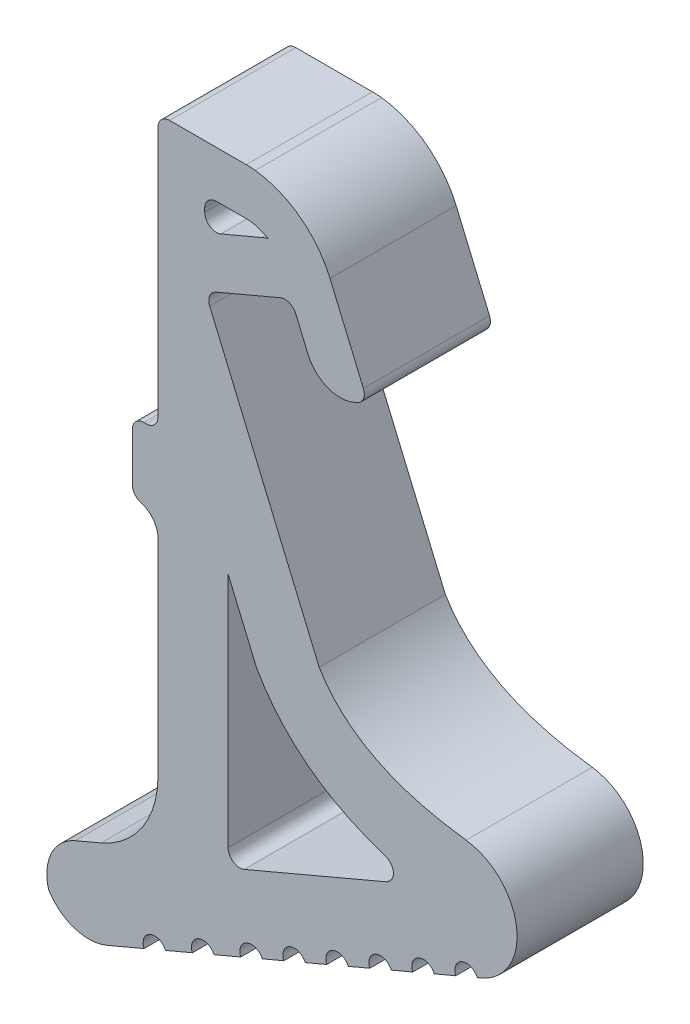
SolidWorks part; units mm, degrees
ref_plane "前视基准面" through (0, 0, 0) normal (0, 0, 1) x (1, 0, 0)
ref_plane "上视基准面" through (0, 0, 0) normal (0, 1, 0) x (1, 0, 0)
ref_plane "右视基准面" through (0, 0, 0) normal (1, 0, 0) x (0, 0, -1)
sketch "草图1" plane through (0, 0, 0) normal (0, 0, 1) x (1, 0, 0)
  line L0 (0, 31) -> (0, -31)
  line L1 (0, -31) -> (29.0782, -18.6571)
  line L2 (29.0782, -18.6571) -> (8, 31)
  line L3 (0, 31) -> (8, 31)
  dimension "D1" = 67
  dimension "D2" = 8
  dimension "D3" = 62
extrude "凸台-拉伸1" add sketch "草图1" along normal mid plane 10.8
sketch "草图2" plane through (0, 0, 0) normal (-1, 0, 0) x (0, 0, 1)
  line L0 (5.4, 31) -> (-5.4, 31) construction
  circle A0 centre (0, 26) radius 1.65
  circle A1 centre (0, 13) radius 1.65
  point P4 (0, 31)
  dimension "D3" = 3.3
  dimension "D4" = 3.3
  dimension "D1" = 5
  dimension "D2" = 13
extrude "切除-拉伸1" cut sketch "草图2" against normal blind 5 draft 5
fillet "圆角1" radius 0.6 2 edges at (0, 13, 1.65) (0, 26, 1.65)
sketch "草图3" plane through (0, 0, 0) normal (-1, 0, 0) x (0, 0, 1)
  line L0 (-5.4, 31) -> (-5.4, -31) construction
  line L1 (-5.4, 7.5) -> (5.4, 7.5)
  line L2 (-5.4, 7.5) -> (-5.4, 1.5)
  line L3 (-5.4, 1.5) -> (5.4, 1.5)
  line L4 (5.4, 7.5) -> (5.4, 1.5)
  line L5 (5.4, 31) -> (5.4, -31) construction
  line L6 (5.4, 31) -> (-5.4, 31) construction
  dimension "D1" = 23.5
  dimension "D2" = 6
extrude "凸台-拉伸2" add sketch "草图3" along normal blind 2.2
fillet "圆角2" radius 2 1 edges at (0, 1.5, 0)
fillet "圆角3" radius 1 4 edges at (-2.2, 1.5, 0) (-2.2, 7.5, 0) (0, 7.5, 0) (0, 31, 0)
sketch "草图4" plane through (0, 0, 5.4) normal (0, 0, 1) x (1, 0, 0)
  line L0 (14.0211, 16.8152) -> (8, 31)
  line L1 (29.0782, -18.6571) -> (8, 31) construction
  line L2 (14.0211, 16.8152) -> (17.9793, 18.4953)
  line L3 (17.9793, 18.4953) -> (12.8998, 30.4619)
  line L4 (8, 31) -> (12.8998, 30.4619)
  line L5 (0, -31) -> (29.0782, -18.6571) construction
  dimension "D2" = 4.3
  dimension "D3" = 10
  dimension "D4" = 13
extrude "凸台-拉伸3" add sketch "草图4" against normal up to surface (10.8 mm away)
fillet "圆角4" radius 8 2 edges at (12.8998, 30.4619, 0) (8, 31, 0)
sketch "草图5" plane through (0, 0, 5.4) normal (0, 0, 1) x (1, 0, 0)
  line L0 (14.0211, 16.8152) -> (11.4032, 22.9826)
  line L1 (11.4032, 22.9826) -> (4.0392, 19.8567)
  line L2 (4.0392, 19.8567) -> (27.483, -35.3736)
  line L3 (27.483, -35.3736) -> (34.8471, -32.2477)
  line L4 (29.0782, -18.6571) -> (14.0211, 16.8152) construction
  line L5 (34.8471, -32.2477) -> (14.0211, 16.8152)
  dimension "D1" = 8
  dimension "D2" = 60
  dimension "D3" = 6.7
extrude "切除-拉伸2" cut sketch "草图5" against normal through all
fillet "圆角5" radius 1 3 edges at (17.9793, 18.4953, 0) (4.0392, 19.8567, 0) (11.4032, 22.9826, 0)
sketch "草图7" plane through (0, 0, 5.4) normal (0, 0, 1) x (1, 0, 0)
  line L0 (4.4299, 18.9362) -> (21.7141, -21.7829) construction
  line L1 (45.6655, -11.6162) -> (21.7141, -21.7829)
  line L2 (21.7141, -21.7829) -> (13.8074, -3.1559)
  line L3 (10.4827, 22.5919) -> (4.9597, 20.2475) construction
  spline S0 degree 3 poles (13.8074, -3.1559) (16.8964, -8.2996) (24.5273, -9.6655) (31.4528, -10.097) (37.8839, -15.122) (43.0045, -10.4837) (45.6655, -11.6162) knots 0 0 0 0 0.425361 0.489671 0.626053 1 1 1 1
  dimension "D1" = 20
  dimension "D3" = 21.846
  dimension "D4" = 17.6685
  dimension "D6" = 34.7414
  dimension "D7" = 30.0901
  dimension "D2" = 25
  dimension "D5" = 45.6655
  dimension "D8" = 35.7375
  dimension "D9" = 10.0776
extrude "凸台-拉伸4" add sketch "草图7" against normal up to surface (10.8 mm away)
fillet "圆角6" radius 5 2 edges at (45.6655, -11.6162, 0) (0, -31, 0)
sketch "草图8" plane through (0, 0, 5.4) normal (0, 0, 1) x (1, 0, 0)
  line L0 (6, 0) -> (10.0908, 0)
  line L1 (8.7863, -15.4458) -> (13.0999, -4.6366)
  line L2 (10.755, -23.7546) -> (18.0211, -12.02)
  line L14 (7.562, 28) -> (3, 28)
  line L15 (7.562, 28) -> (3, 28)
  line L16 (7.562, 27) -> (4, 27)
  line L17 (7.562, 27) -> (4, 27)
  line L24 (4, 24.1856) -> (8.9198, 26.2739)
  line L26 (4, 27) -> (4, 24.1856)
  line L27 (4, 24.1856) -> (8.9198, 26.2739)
  line L29 (4, 25.985) -> (4, 22.6279)
  line L44 (3.7875, 23.009) -> (9.3105, 25.3534)
  line L47 (3, 28) -> (3, 22.5636)
  arc A0 (8.5264, 26.0863) -> (8.7287, 27.7101) centre (8.057, 26.9693) ccw
  arc A1 (5.2536, 21.6606) -> (4, 22.6279) centre (5, 22.6279) cw
  arc A2 (5.0547, 26.9835) -> (4, 25.985) centre (5, 25.985) ccw
  arc A3 (10.0908, 0) -> (12.8523, -1.8278) centre (10.0908, -3) cw
  arc A4 (6, 0) -> (3, -3) centre (6, -3) ccw
  arc A5 (14.4779, -28.0954) -> (10.755, -23.7546) centre (13.3057, -25.3339) cw
  arc A6 (3, -14.3339) -> (8.7863, -15.4458) centre (6, -14.3339) ccw
  arc A7 (18.0211, -12.02) -> (21.7862, -10.8562) centre (20.5717, -13.5994) cw
  arc A8 (13.0999, -4.6366) -> (13.075, -2.3525) centre (10.3135, -3.5247) ccw
  arc A22 (9.4189, 26.4551) -> (7.9011, 26.9856) centre (7.3672, 23.0214) ccw
  arc A23 (9.4189, 26.4551) -> (7.9011, 26.9856) centre (7.3672, 23.0214) ccw
  arc A24 (7.9011, 26.9856) -> (7.562, 27) centre (7.562, 23) ccw
  arc A25 (7.9011, 26.9856) -> (7.562, 27) centre (7.562, 23) ccw
  arc A26 (11.6543, 25.5944) -> (8.0103, 27.9799) centre (7.3672, 23.0214) ccw
  arc A27 (9.4189, 26.4551) -> (8.9198, 26.2739) centre (10.8734, 21.6713) ccw
  arc A28 (8.0103, 27.9799) -> (7.562, 28) centre (7.562, 23) ccw
  arc A31 (8.5264, 26.0863) -> (8.9198, 26.2739) centre (10.8734, 21.6713) ccw
  arc A48 (3.7875, 23.009) -> (3, 22.5636) centre (5.3504, 19.327) ccw
  arc A49 (11.6543, 25.5944) -> (9.3105, 25.3534) centre (10.8734, 21.6713) ccw
  point P13 (12.0765, 0)
  point P16 (3, 0)
  dimension "D3" = 1
  dimension "D4" = 3
  dimension "D5" = 3
  dimension "D6" = 3
  dimension "D7" = 21.6496
  dimension "D1" = 4
  dimension "D2" = 3
extrude "切除-拉伸3" [suppressed] cut sketch "草图8" against normal through all
sketch "草图11" plane through (0, 0, 5.4) normal (0, 0, 1) x (1, 0, 0)
  line L22 (6, -21.935) -> (22.2227, -15.0489)
  line L23 (8.448, -5.8858) -> (5.9897, -0.0943)
  line L24 (6, -0.5) -> (6, -21.935)
  line L25 (7.3907, -21.3447) -> (19.551, -16.1829)
  line L26 (8.448, -5.8858) -> (5.9897, -0.0943)
  line L27 (6, -0.5) -> (6, -20.4242)
  line L39 (4, 24.1856) -> (8.9198, 26.2739)
  line L40 (7.562, 27) -> (4, 27)
  line L41 (4, 27) -> (4, 24.1856)
  line L42 (5.3907, 24.7759) -> (8.9198, 26.2739)
  line L43 (7.562, 27) -> (5, 27)
  line L44 (4, 26) -> (4, 25.6964)
  arc A26 (6, -0.5) -> (5.9897, -0.0943) centre (-2, -0.5) ccw
  arc A27 (6, -0.5) -> (5.9897, -0.0943) centre (-2, -0.5) ccw
  arc A28 (19.551, -16.1829) -> (19.4662, -14.3104) centre (19.1602, -15.2624) ccw
  arc A29 (7.3907, -21.3447) -> (6, -20.4242) centre (7, -20.4242) cw
  arc A30 (5.3907, 24.7759) -> (4, 25.6964) centre (5, 25.6964) cw
  arc A31 (5, 27) -> (4, 26) centre (5, 26) ccw
  arc A41 (9.4189, 26.4551) -> (8.9198, 26.2739) centre (10.8734, 21.6713) ccw
  arc A42 (9.4189, 26.4551) -> (7.9011, 26.9856) centre (7.3672, 23.0214) ccw
  arc A43 (7.9011, 26.9856) -> (7.562, 27) centre (7.562, 23) ccw
  arc A44 (9.4189, 26.4551) -> (8.9198, 26.2739) centre (10.8734, 21.6713) ccw
  arc A45 (9.4189, 26.4551) -> (7.9011, 26.9856) centre (7.3672, 23.0214) ccw
  arc A46 (7.9011, 26.9856) -> (7.562, 27) centre (7.562, 23) ccw
  spline S2 degree 3 poles (-523.6377, -1935.4123) (230.3795, 174.8284) (78.4666, -36.8926) (16.8315, -13.3447) (15.5565, -12.7295) (13.126, -11.2031) (12.0174, -10.3205) (10.5314, -8.7982) (10.0641, -8.2555) (9.4162, -7.395) (9.2099, -7.1017) (-0.8865, 8.2953) (21.6139, 45.1609) (-1680.4202, -1076.6214) knots -11.194398 -11.194398 -11.194398 -11.194398 0.25 0.25 0.5 0.5 0.75 0.75 0.875 0.875 0.9375 0.9375 4.08444 4.08444 4.08444 4.08444 only from (22.2227, -15.0489) to (8.448, -5.8858)
  spline S3 degree 3 poles (19.4662, -14.3104) (19.0227, -14.1678) (18.5835, -14.0141) (16.8315, -13.3447) (15.5565, -12.7295) (13.126, -11.2031) (12.0174, -10.3205) (10.5314, -8.7982) (10.0641, -8.2555) (9.4162, -7.395) (9.2099, -7.1017) (8.8167, -6.502) (8.6329, -6.1936) (8.448, -5.8858) knots 0.167576 0.167576 0.167576 0.167576 0.25 0.25 0.5 0.5 0.75 0.75 0.875 0.875 0.9375 0.9375 1 1 1 1
  dimension "D3" = 1
  dimension "D1" = 6
  dimension "D2" = 4
extrude "切除-拉伸6" cut sketch "草图11" against normal through all
sketch "草图12" plane through (0, 0, 5.4) normal (0, 0, 1) x (1, 0, 0)
  line L0 (6.9537, -28.0483) -> (27.7033, -19.2406) construction
  circle A0 centre (8.0099, -27.6) radius 1
  dimension "D2" = 2
  dimension "D1" = 27.6
extrude "切除-拉伸7" cut sketch "草图12" against normal through all
pattern_linear "阵列(线性)2" count 6 spacing 4 along (0.9205, 0.3907, 0) of "切除-拉伸7"
sketch "草图9" plane through (0, 0, 5.4) normal (0, 0, 1) x (1, 0, 0)
  line L23 (7.5548, -6.3408) -> (7, -5.0337)
  line L24 (7, -5.0337) -> (7, -19.5574)
  line L26 (7.5548, -6.3408) -> (7, -5.0337)
  line L27 (7, -5.0337) -> (7, -18.0466)
  arc A0 (16.8972, -16.2231) -> (16.8571, -14.4034) centre (16.4628, -15.3223) ccw
  arc A1 (8.3907, -18.9671) -> (7, -18.0466) centre (8, -18.0466) cw
  arc A21 (10.5063, -18.1254) -> (7, -19.5574) centre (11.6919, -26.0371) ccw
  arc A22 (10.5063, -18.1254) -> (7, -19.5574) centre (11.6919, -26.0371) ccw
  arc A23 (14.1884, -16.5625) -> (10.5063, -18.1254) centre (15.3739, -24.4742) ccw
  arc A24 (14.1884, -16.5625) -> (10.5063, -18.1254) centre (15.3739, -24.4742) ccw
  arc A25 (18.2494, -14.952) -> (14.1884, -16.5625) centre (19.056, -22.9112) ccw
  arc A26 (18.2494, -14.952) -> (14.1884, -16.5625) centre (19.056, -22.9112) ccw
  spline S2 degree 3 poles (-690.5665, -1880.7396) (275.8487, 204.7486) (74.8449, -45.6605) (14.5317, -13.2556) (14.0281, -12.9585) (13.0437, -12.3181) (12.5603, -11.9727) (11.1729, -10.88) (10.3306, -10.0779) (9.1942, -8.7616) (8.8366, -8.3039) (8.333, -7.5882) (8.1706, -7.3447) (-0.9842, 7.1527) (11.8898, 40.8929) (-1517.4111, -1299.6796) knots -14.28836 -14.28836 -14.28836 -14.28836 0.25 0.25 0.375 0.375 0.5 0.5 0.75 0.75 0.875 0.875 0.9375 0.9375 4.522796 4.522796 4.522796 4.522796 only from (18.2494, -14.952) to (7.5548, -6.3408)
  spline S3 degree 3 poles (16.8571, -14.4034) (16.2405, -14.1387) (15.6363, -13.8491) (14.5317, -13.2556) (14.0281, -12.9585) (13.0437, -12.3181) (12.5603, -11.9727) (11.1729, -10.88) (10.3306, -10.0779) (9.1942, -8.7616) (8.8366, -8.3039) (8.333, -7.5882) (8.1706, -7.3447) (7.8569, -6.848) (7.7067, -6.5936) (7.5548, -6.3408) knots 0.106462 0.106462 0.106462 0.106462 0.25 0.25 0.375 0.375 0.5 0.5 0.75 0.75 0.875 0.875 0.9375 0.9375 1 1 1 1
  dimension "D2" = 1
  dimension "D1" = 7
extrude "切除-拉伸4" [suppressed] cut sketch "草图9" against normal through all
sketch "草图10" plane through (0, 0, 5.4) normal (0, 0, 1) x (1, 0, 0)
  line L0 (6.9537, -28.0483) -> (7.0894, -27.9907) construction
  circle A0 centre (1.1779, -30.5) radius 1
  dimension "D2" = 2
  dimension "D1" = 30.5
extrude "切除-拉伸5" [suppressed] cut sketch "草图10" against normal through all
pattern_linear "阵列(线性)1" [suppressed] count 6 spacing 5
fillet "圆角7" radius 3 1 edges at (14.0211, 16.8152, 0)
sketch "草图14" plane through (0, 0, 5.4) normal (0, 0, 1) x (1, 0, 0)
  line L0 (6.9537, -28.0483) -> (-8.0463, -34.4155)
  line L1 (-8.0463, -34.4155) -> (-10.7634, -28.0146)
  line L2 (-10.7634, -28.0146) -> (0, -23.4458)
  line L3 (0, -0.5) -> (0, -23.4458) construction
  line L4 (8.9304, -27.2093) -> (10.7714, -26.4278) construction
  line L21 (11.7939, 22.0621) -> (12.8489, 19.5767)
  line L22 (16.7826, 17.9874) -> (17.0588, 18.1046)
  line L23 (17.5885, 19.4159) -> (14.7312, 26.1472)
  line L24 (7.562, 31) -> (1, 31)
  line L25 (0, 30) -> (0, 8.5)
  line L26 (-1, 7.5) -> (-1.2, 7.5)
  line L27 (-2.2, 6.5) -> (-2.2, 2.3914)
  line L28 (0, -0.5) -> (0, -23.4458)
  line L29 (6.9537, -28.0483) -> (7.0894, -27.9907)
  line L30 (8.9304, -27.2093) -> (10.7714, -26.4278)
  line L31 (12.6124, -25.6463) -> (14.4534, -24.8649)
  line L32 (16.2944, -24.0834) -> (18.1355, -23.302)
  line L33 (19.9765, -22.5205) -> (21.8175, -21.739)
  line L34 (23.6585, -20.9576) -> (25.4995, -20.1761)
  line L35 (27.3405, -19.3946) -> (27.7033, -19.2406)
  line L36 (13.8074, -3.1559) -> (4.4299, 18.9362)
  line L37 (4.9597, 20.2475) -> (10.4827, 22.5919)
  arc A19 (12.8489, 19.5767) -> (16.7826, 17.9874) centre (15.6104, 20.7489) ccw
  arc A20 (17.0588, 18.1046) -> (17.5885, 19.4159) centre (16.668, 19.0251) ccw
  arc A21 (14.7312, 26.1472) -> (8.3379, 30.9623) centre (7.3672, 23.0214) ccw
  arc A22 (8.3379, 30.9623) -> (7.562, 31) centre (7.562, 23) ccw
  arc A23 (1, 31) -> (0, 30) centre (1, 30) ccw
  arc A24 (-1, 7.5) -> (0, 8.5) centre (-1, 8.5) ccw
  arc A25 (-1.2, 7.5) -> (-2.2, 6.5) centre (-1.2, 6.5) ccw
  arc A26 (-2.2, 2.3914) -> (-1.4667, 1.4276) centre (-1.2, 2.3914) ccw
  arc A27 (0, -0.5) -> (-1.4667, 1.4276) centre (-2, -0.5) ccw
  arc A28 (0, -23.4458) -> (6.9537, -28.0483) centre (5, -23.4458) ccw
  arc A29 (8.9304, -27.2093) -> (7.0894, -27.9907) centre (8.0099, -27.6) ccw
  arc A30 (12.6124, -25.6463) -> (10.7714, -26.4278) centre (11.6919, -26.0371) ccw
  arc A31 (16.2944, -24.0834) -> (14.4534, -24.8649) centre (15.3739, -24.4742) ccw
  arc A32 (19.9765, -22.5205) -> (18.1355, -23.302) centre (19.056, -22.9112) ccw
  arc A33 (23.6585, -20.9576) -> (21.8175, -21.739) centre (22.738, -21.3483) ccw
  arc A34 (27.3405, -19.3946) -> (25.4995, -20.1761) centre (26.42, -19.7854) ccw
  arc A35 (27.7033, -19.2406) -> (26.384, -9.6785) centre (25.7497, -14.6381) ccw
  arc A36 (4.9597, 20.2475) -> (4.4299, 18.9362) centre (5.3504, 19.327) ccw
  arc A37 (11.7939, 22.0621) -> (10.4827, 22.5919) centre (10.8734, 21.6713) ccw
  arc A47 (0, -23.4458) -> (6.9537, -28.0483) centre (5, -23.4458) ccw
  spline S1 degree 3 poles (-868.8518, -455.2666) (984.6368, 497.6645) (-876.7239, -594.5333) (754.5147, 668.6632) knots -1.731774 -1.731774 -1.731774 -1.731774 3.007683 3.007683 3.007683 3.007683 only from (26.384, -9.6785) to (13.8074, -3.1559)
  dimension "D2" = 15
  dimension "D1" = 0
extrude "凸台-拉伸5" add sketch "草图14" against normal up to surface (10.8 mm away)
fillet "圆角8" radius 4 2 edges at (-8.0463, -34.4155, 0) (-10.7634, -28.0146, 0)
fillet "圆角9" radius 8 1 edges at (0, -23.4458, 0)
pattern_linear "阵列(线性)3" count 3 spacing 4.5 along (-0.9205, -0.3907, 0) of "切除-拉伸7"
